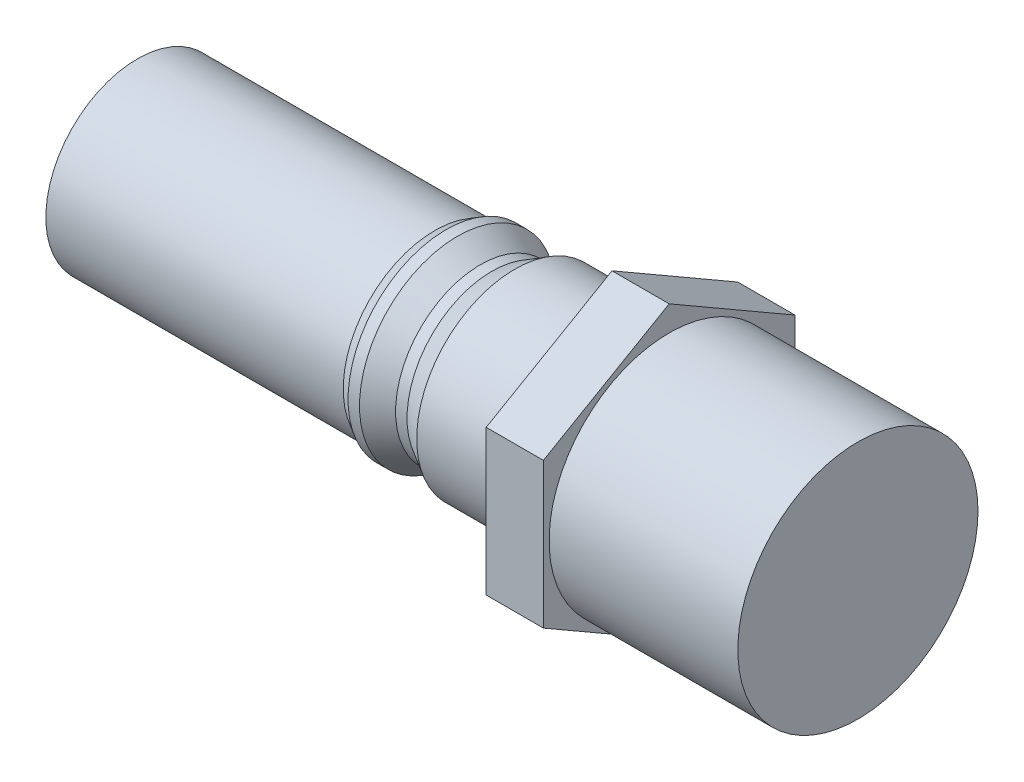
SolidWorks part; units mm, degrees
ref_plane "Alzado" through (0, 0, 0) normal (0, 0, 1) x (1, 0, 0)
ref_plane "Planta" through (0, 0, 0) normal (0, 1, 0) x (1, 0, 0)
ref_plane "Vista lateral" through (0, 0, 0) normal (1, 0, 0) x (0, 0, -1)
sketch "Croquis1" plane through (0, 0, 0) normal (0, 0, 1) x (1, 0, 0)
  line L0 (0, 0) -> (41.5, 0) construction
  line L1 (0, 0) -> (0, 8)
  line L2 (0, 8) -> (26, 8)
  line L3 (26, 8) -> (27, 8.5774)
  line L4 (27, 8.5774) -> (28, 8.5774)
  line L5 (27.5, 8.5774) -> (27.5, 0) construction
  line L6 (29, 8) -> (28, 8.5774)
  line L7 (29, 8) -> (30, 7.4226)
  line L8 (30, 7.4226) -> (31, 7.4226)
  line L9 (30.5, 7.4226) -> (30.5, 0) construction
  line L10 (32, 8) -> (31, 7.4226)
  line L11 (32, 8) -> (33, 8.5774)
  line L12 (33, 8.5774) -> (41.5, 8.5774)
  line L13 (41.5, 8.5774) -> (41.5, 0)
  line L14 (41.5, 0) -> (0, 0)
  dimension "D1" = 16
  dimension "D2" = 26
  dimension "D3" = 1
  dimension "D4" = 1
  dimension "D5" = 150
  dimension "D6" = 1
  dimension "D7" = 1
  dimension "D8" = 8.5
revolve "Revolución1" add sketch "Croquis1" angle 360 about L14
sketch "Croquis4" plane through (41.5, 0, 0) normal (1, 0, 0) x (0, 0, -1)
  line L1 (0, 12.7017) -> (-11, 6.3509)
  line L2 (-11, 6.3509) -> (-11, -6.3509)
  line L3 (-11, -6.3509) -> (0, -12.7017)
  line L4 (0, -12.7017) -> (11, -6.3509)
  line L5 (11, -6.3509) -> (11, 6.3509)
  line L6 (11, 6.3509) -> (0, 12.7017)
  circle A0 centre (0, 0) radius 11 construction
  dimension "D1" = 22
extrude "Saliente-Extruir3" add sketch "Croquis4" along normal blind 5
sketch "Croquis5" plane through (46.5, 0, 0) normal (1, 0, 0) x (0, 0, -1)
  circle A0 centre (0, 0) radius 10.5
  dimension "D1" = 21
extrude "Saliente-Extruir4" add sketch "Croquis5" along normal blind 16.5
